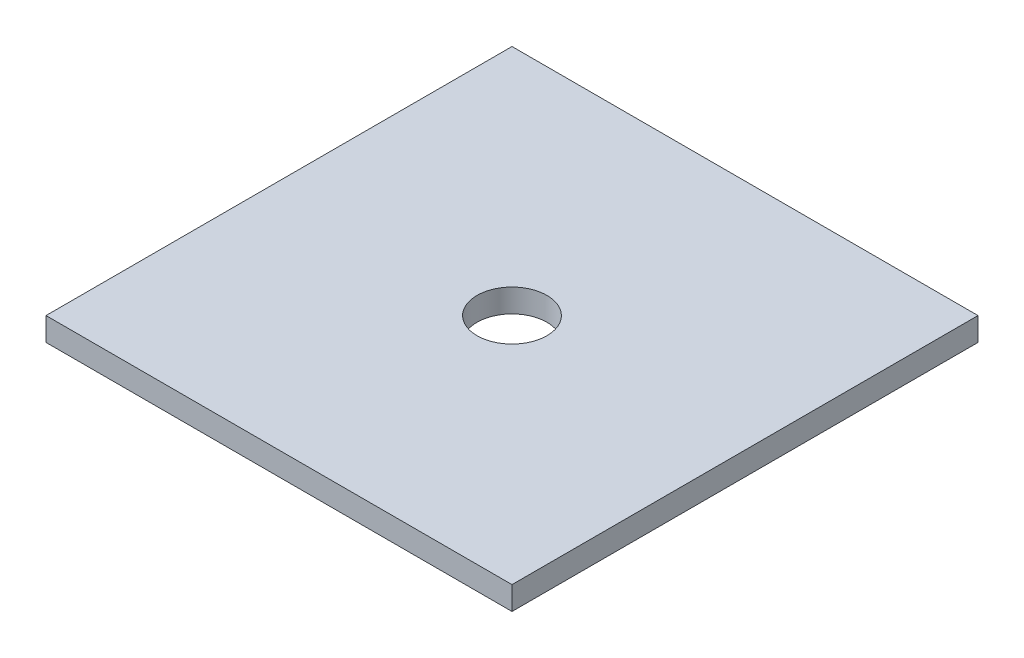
SolidWorks part; units mm, degrees
ref_plane "Front Plane" through (0, 0, 0) normal (0, 0, 1) x (1, 0, 0)
ref_plane "Top Plane" through (0, 0, 0) normal (0, 1, 0) x (1, 0, 0)
ref_plane "Right Plane" through (0, 0, 0) normal (1, 0, 0) x (0, 0, -1)
sketch "Sketch1" plane through (0, 0, 0) normal (0, 1, 0) x (1, 0, 0)
  line L0 (60, 60) -> (0, 0) construction
  line L1 (0, 0) -> (60, 0)
  line L2 (0, 0) -> (0, 60)
  line L3 (0, 60) -> (60, 60)
  line L4 (60, 0) -> (60, 60)
  circle A0 centre (30, 30) radius 4.5
  dimension "D2" = 9
  dimension "D1" = 60
extrude "Extrude1" add sketch "Sketch1" along normal blind 3
